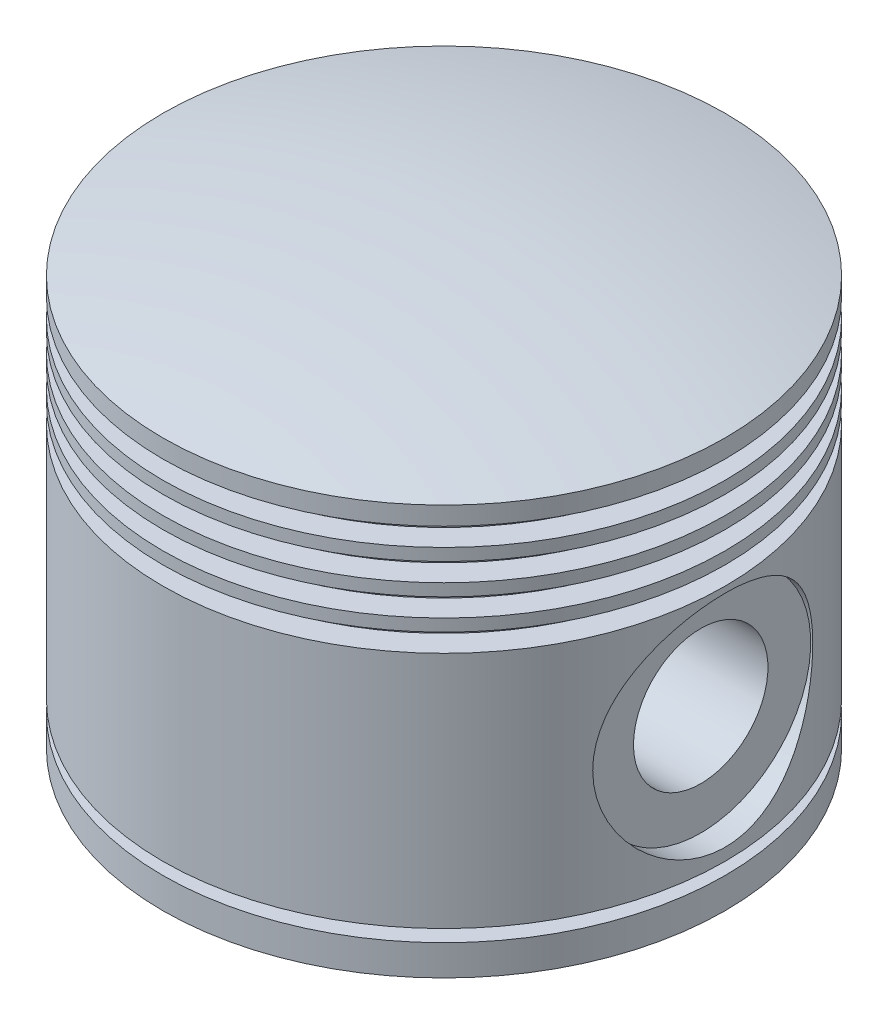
SolidWorks part; units mm, degrees
ref_plane "Front Plane" through (0, 0, 0) normal (0, 0, 1) x (1, 0, 0)
ref_plane "Top Plane" through (0, 0, 0) normal (0, 1, 0) x (1, 0, 0)
ref_plane "Right Plane" through (0, 0, 0) normal (1, 0, 0) x (0, 0, -1)
sketch "Sketch1" plane through (0, 0, 0) normal (0, 0, 1) x (1, 0, 0)
  line L0 (0, 39.592) -> (0, 0) construction
  line L1 (37, 62) -> (37, 42)
  line L2 (37, 0) -> (46, 0)
  line L3 (46, 0) -> (46, 5)
  line L4 (46, 5) -> (42, 5)
  line L5 (42, 5) -> (42, 7)
  line L6 (42, 7) -> (46, 7)
  line L7 (46, 7) -> (46, 46)
  line L8 (46, 46) -> (42, 46)
  line L9 (42, 46) -> (42, 49)
  line L10 (42, 49) -> (46, 49)
  line L11 (46, 49) -> (46, 51)
  line L12 (46, 51) -> (42, 51)
  line L13 (42, 51) -> (42, 54)
  line L14 (42, 54) -> (46, 54)
  line L15 (46, 54) -> (46, 56)
  line L16 (46, 56) -> (42, 56)
  line L17 (42, 56) -> (42, 59)
  line L18 (42, 59) -> (46, 59)
  line L19 (46, 59) -> (46, 61)
  line L20 (46, 61) -> (42, 61)
  line L21 (42, 61) -> (42, 64)
  line L22 (42, 64) -> (46, 64)
  line L23 (46, 64) -> (46, 67)
  line L24 (37, 62) -> (0, 62)
  line L25 (0, 62) -> (0, 72.6833)
  line L26 (37, 12) -> (37, 0)
  line L27 (37, 42) -> (38.5, 42)
  line L28 (-15.3218, 27) -> (27.939, 27) construction
  line L29 (37, 12) -> (38.5, 12)
  line L30 (38.5, 42) -> (38.5, 12)
  arc A0 (46, 67) -> (0, 72.6833) centre (0, -116.3167) ccw
  point P36 (38.5, 27)
  dimension "D4" = 189
  dimension "D1" = 74
  dimension "D2" = 92
  dimension "D3" = 84
  dimension "D5" = 3
  dimension "D6" = 2
  dimension "D7" = 7
  dimension "D8" = 62
  dimension "D9" = 39
  dimension "D10" = 77
  dimension "D11" = 30
  dimension "D12" = 84
  dimension "D13" = 12
revolve "Revolve1" add sketch "Sketch1" angle 360 about L0
ref_plane "Plane1" through (25, 0, 0) normal (1, 0, 0) x (0, 0, -1)
sketch "Sketch3" plane through (25, 0, 0) normal (1, 0, 0) x (0, 0, -1)
  circle A0 centre (0, 27) radius 19.25
  dimension "D1" = 38.5
  dimension "D2" = 27
extrude "Boss-Extrude1" add sketch "Sketch3" along normal up to next
sketch "Sketch5" plane through (0, 0, 0) normal (0, 0, 1) x (1, 0, 0)
  line L0 (-14.7244, 27) -> (55.0446, 27) construction
  line L2 (-46, 0) -> (46, 0) construction
  line L3 (46, 7) -> (46, 46) construction
  line L4 (42, 46) -> (42, 49) construction
  line L5 (25, 46.25) -> (25, 7.75) construction
  line L9 (25, 27) -> (46, 27)
  line L10 (25, 38) -> (25, 27)
  line L11 (42, 38) -> (25, 38)
  line L12 (42, 45) -> (42, 38)
  line L13 (46, 45) -> (42, 45)
  line L14 (46, 27) -> (46, 45)
  dimension "D1" = 27
  dimension "D2" = 36
  dimension "D3" = 22
revolve "Cut-Revolve1" cut sketch "Sketch5" angle 360 about L0
mirror "Mirror1" about plane through (0, 0, 0) normal (1, 0, 0) of "Cut-Revolve1", "Boss-Extrude1"
